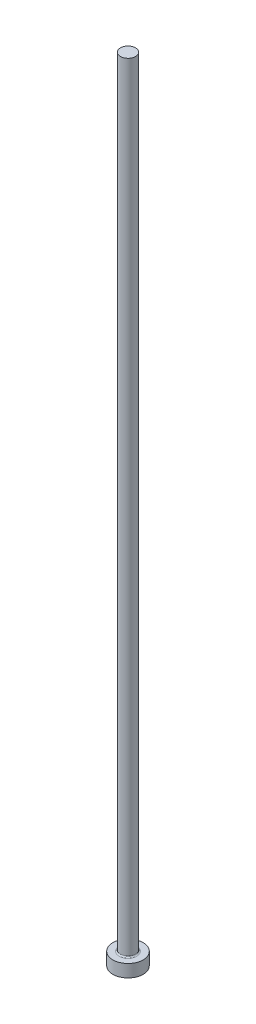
SolidWorks part; units mm, degrees
ref_plane "Plano frontal" through (0, 0, 0) normal (0, 0, 1) x (1, 0, 0)
ref_plane "Plano superior" through (0, 0, 0) normal (0, 1, 0) x (1, 0, 0)
ref_plane "Plano direito" through (0, 0, 0) normal (1, 0, 0) x (0, 0, -1)
sketch "Esboço1" plane through (0, 0, 0) normal (0, 0, 1) x (1, 0, 0)
  line L0 (0, 0) -> (6, 0)
  line L1 (6, 0) -> (6, 5)
  line L2 (6, 5) -> (3.5, 5)
  line L3 (3, 5.5) -> (3, 315)
  line L4 (3, 315) -> (0, 315)
  line L5 (0, 315) -> (0, 0) construction
  line L6 (0, 0) -> (0, 315)
  arc A0 (3.5, 5) -> (3, 5.5) centre (3.5, 5.5) cw
  dimension "D3" = 0.5
  dimension "D1" = 12
  dimension "D2" = 6
  dimension "D4" = 5
  dimension "D5" = 315
revolve "Revolução1" add sketch "Esboço1" angle 360 about L5
sketch "Esboço2"
  dimension "D1" = 3.225
  dimension "D2" = 1.05
  dimension "D3" = 0.675
  dimension "D4" = 0.45
wrap "Envolver1" sketch "Esboço2" wrap type deboss source sketch "Esboço2" thickness 0.1 parameters "D1"=0.1
